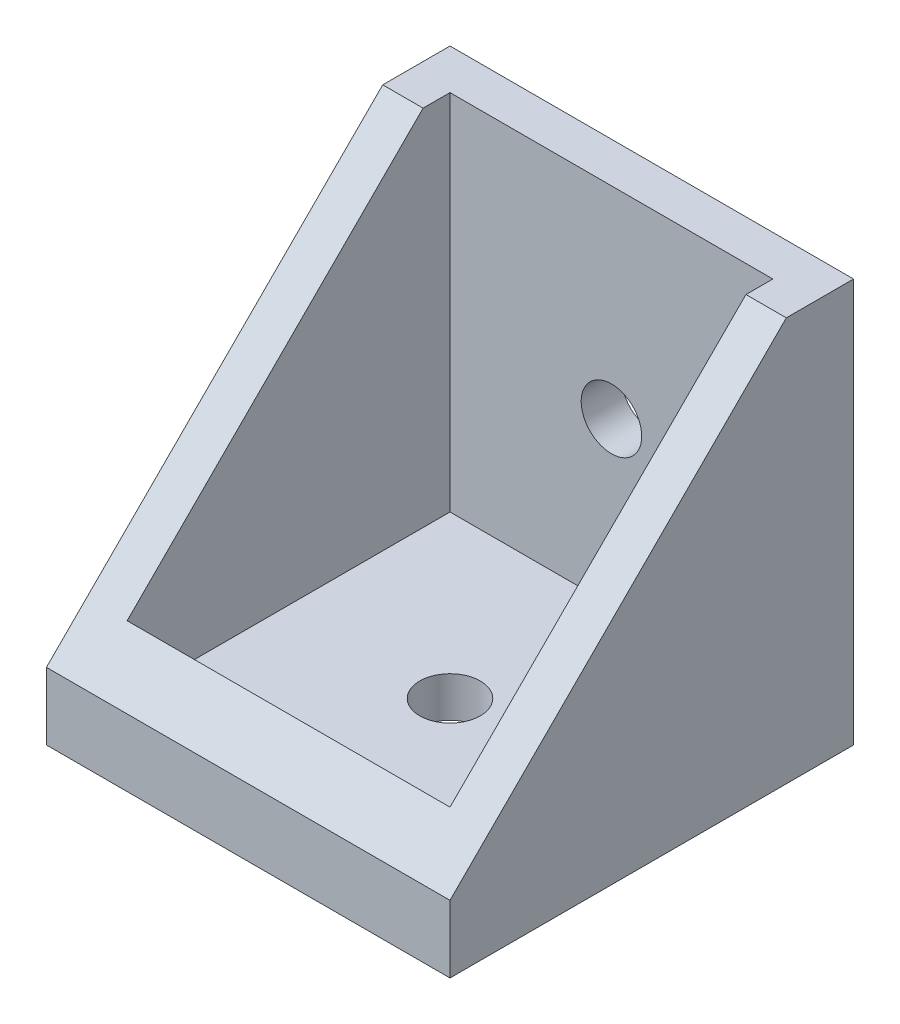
SolidWorks part; units mm, degrees
ref_plane "Front Plane" through (0, 0, 0) normal (0, 0, 1) x (1, 0, 0)
ref_plane "Top Plane" through (0, 0, 0) normal (0, 1, 0) x (1, 0, 0)
ref_plane "Right Plane" through (0, 0, 0) normal (1, 0, 0) x (0, 0, -1)
sketch "Sketch1" plane through (0, 0, 0) normal (0, 1, 0) x (1, 0, 0)
  line L0 (-15, 15) -> (15, -15) construction
  line L1 (-15, 15) -> (15, 15)
  line L2 (-15, 15) -> (-15, -15)
  line L3 (-15, -15) -> (15, -15)
  line L4 (15, 15) -> (15, -15)
  dimension "D1" = 30
  dimension "D2" = 30
extrude "Boss-Extrude1" add sketch "Sketch1" along normal blind 30
sketch "Sketch2" plane through (0, 30, 0) normal (0, 1, 0) x (1, 0, 0)
  line L0 (15, 15) -> (-15, 15) construction
  line L1 (-12, 12) -> (12, 12)
  line L2 (-12, 12) -> (-12, -12)
  line L3 (-12, -12) -> (12, -12)
  line L4 (12, 12) -> (12, -12)
  line L5 (-15, -15) -> (15, -15) construction
  line L6 (15, -15) -> (15, 15) construction
  line L7 (-15, 15) -> (-15, -15) construction
  dimension "D1" = 3
  dimension "D2" = 3
  dimension "D3" = 3
  dimension "D4" = 3
extrude "Cut-Extrude1" cut sketch "Sketch2" against normal blind 27
sketch "Sketch3" plane through (0, 3, 0) normal (0, 1, 0) x (1, 0, 0)
  circle A0 centre (0, 0) radius 2.25
  dimension "D1" = 4.5
extrude "Cut-Extrude2" cut sketch "Sketch3" against normal through all
sketch "Sketch4" plane through (0, 0, 15) normal (0, 0, 1) x (1, 0, 0)
  line L0 (-15, 30) -> (15, 0) construction
  circle A0 centre (0, 15) radius 2.25
  dimension "D1" = 4.5
extrude "Cut-Extrude3" cut sketch "Sketch4" against normal through all
chamfer "Chamfer1" distance 25 angle 45 1 edges at (0, 30, 15)
